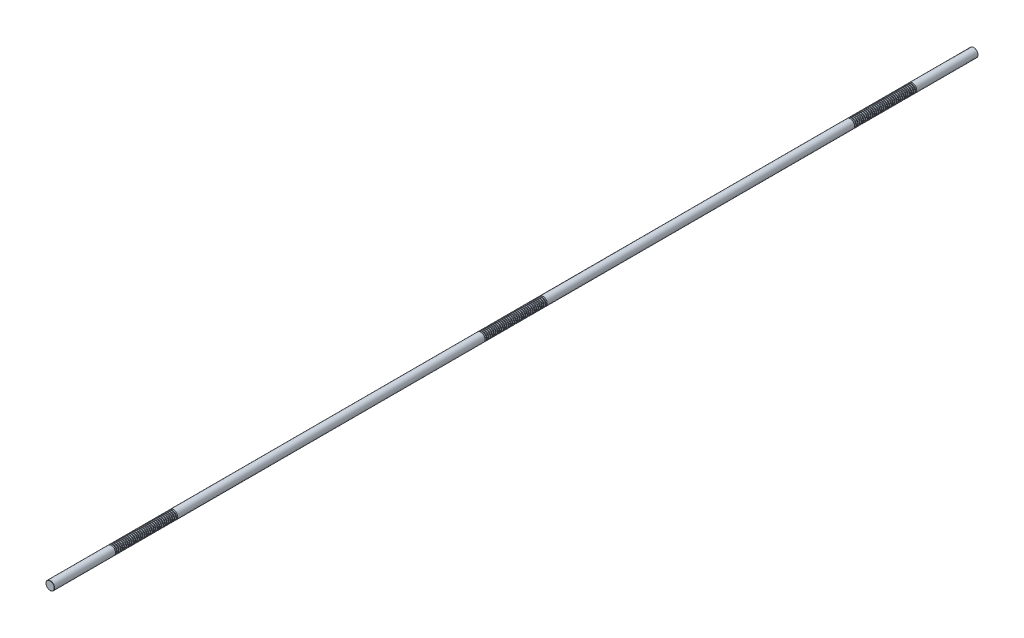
SolidWorks part; units mm, degrees
ref_plane "Front Plane" through (0, 0, 0) normal (0, 0, 1) x (1, 0, 0)
ref_plane "Top Plane" through (0, 0, 0) normal (0, 1, 0) x (1, 0, 0)
ref_plane "Right Plane" through (0, 0, 0) normal (1, 0, 0) x (0, 0, -1)
sketch "Sketch1" plane through (0, 0, 0) normal (0, 0, 1) x (1, 0, 0)
  circle A0 centre (0, 0) radius 7
  dimension "D1" = 14
extrude "Boss-Extrude1" add sketch "Sketch1" along normal mid plane 1500
chamfer "Chamfer1" distance 0.35 angle 45 2 edges at (7, 0, -750) (7, 0, 750)
sketch "Sketch2" plane through (0, 0, 0) normal (1, 0, 0) x (0, 0, -1)
  line L0 (650.2345, 7) -> (648.2655, 7)
  line L1 (749.65, 7) -> (-749.65, 7) construction
  line L2 (648.2655, 7) -> (648.7345, 5.25)
  line L3 (648.7345, 5.25) -> (649.7655, 5.25)
  line L4 (649.7655, 5.25) -> (650.2345, 7)
  line L5 (750, -6.65) -> (750, 6.65) construction
  point P4 (649.25, 7)
  point P7 (649.25, 5.25)
  point P8 (650, 6.125)
  point P9 (648.5, 6.125)
  dimension "D1" = 1.5
  dimension "D2" = 100
  dimension "D3" = 1.75
  dimension "D4" = 30
revolve "Cut-Revolve1" cut sketch "Sketch2" angle 360 about axis through (0, 0, 750) along (0, 0, -1)
pattern_linear "LPattern1" count 34 spacing 3 along (0, 0, 1) of "Cut-Revolve1"
pattern_linear "LPattern2" count 3 spacing 600 along (0, 0, 1) of "Cut-Revolve1", "LPattern1"
